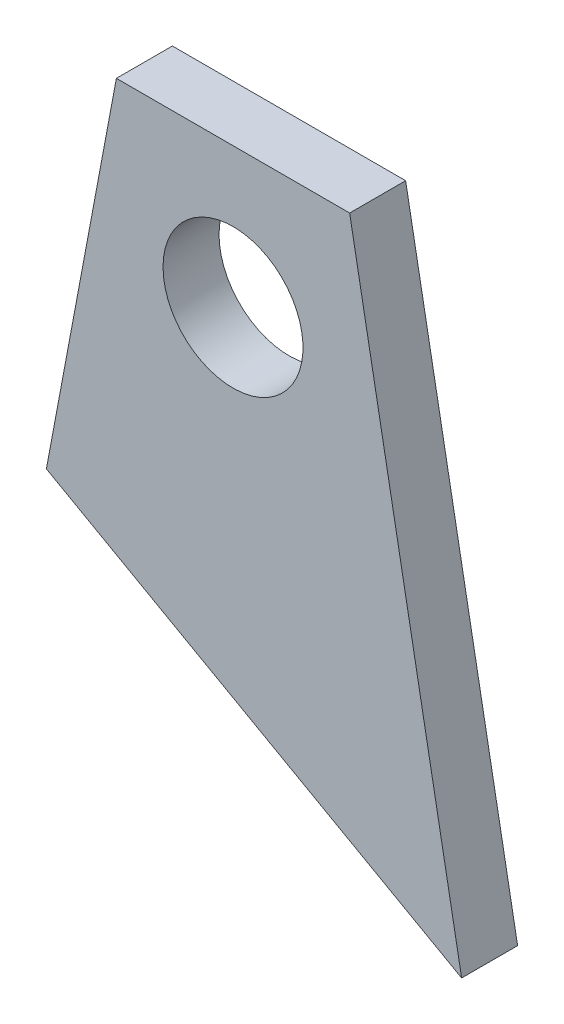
SolidWorks part; units mm, degrees
ref_plane "前视基准面" through (0, 0, 0) normal (0, 0, 1) x (1, 0, 0)
ref_plane "上视基准面" through (0, 0, 0) normal (0, 1, 0) x (1, 0, 0)
ref_plane "右视基准面" through (0, 0, 0) normal (1, 0, 0) x (0, 0, -1)
sketch "草图1" plane through (0, 0, 0) normal (0, 0, 1) x (1, 0, 0)
  line L0 (0, 77.0033) -> (0, -89.8632) construction
  line L1 (-25, 0) -> (25, 0)
  line L2 (25, 0) -> (49, -130)
  line L3 (49, -130) -> (-40, -80)
  line L4 (-40, -80) -> (-25, 0)
  circle A0 centre (0, -30) radius 15
  dimension "D7" = 30
  dimension "D8" = 30
  dimension "D1" = 50
  dimension "D2" = 25
  dimension "D3" = 15
  dimension "D4" = 24
  dimension "D5" = 80
  dimension "D6" = 50
extrude "拉伸1" add sketch "草图1" along normal blind 12
